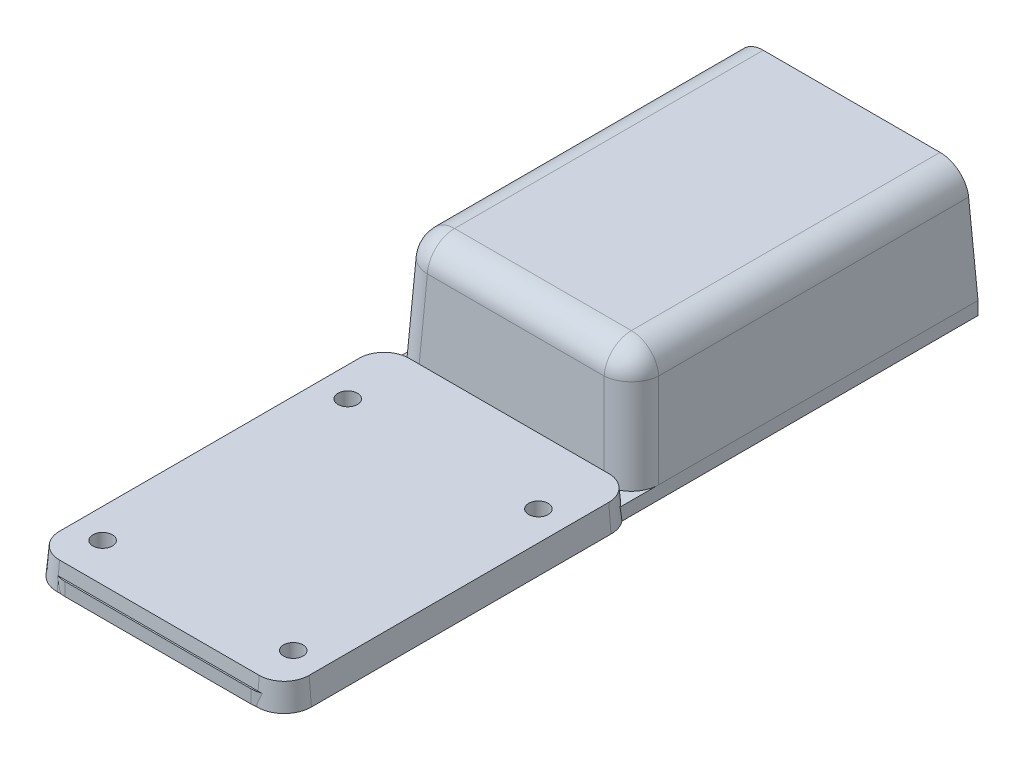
SolidWorks part; units mm, degrees
ref_plane "Front Plane" through (0, 0, 0) normal (0, 0, 1) x (1, 0, 0)
ref_plane "Top Plane" through (0, 0, 0) normal (0, 1, 0) x (1, 0, 0)
ref_plane "Right Plane" through (0, 0, 0) normal (1, 0, 0) x (0, 0, -1)
sketch "Sketch1" plane through (0, 0, 0) normal (0, 1, 0) x (1, 0, 0)
  line L1 (22, -39) -> (-22, -39)
  line L2 (28, -33) -> (28, 33)
  line L3 (22, 39) -> (-22, 39)
  line L4 (-28, -33) -> (-28, 33)
  line L5 (28, -39) -> (-28, 39) construction
  line L6 (28, 39) -> (-28, -39) construction
  arc A0 (-28, -33) -> (-22, -39) centre (-22, -33) ccw
  arc A1 (22, -39) -> (28, -33) centre (22, -33) ccw
  arc A2 (28, 33) -> (22, 39) centre (22, 33) ccw
  arc A3 (-22, 39) -> (-28, 33) centre (-22, 33) ccw
  point P0 (0, 0)
  dimension "D3" = 6
  dimension "D1" = 56
  dimension "D2" = 78
extrude "Boss-Extrude1" add sketch "Sketch1" along normal blind 5.8 draft 5
hole_wizard "Ø4.3 (4.3) Diameter Hole1" positions "Sketch4" profile "Sketch3" hole size "Ø4.3" standard "ANSI Metric"
sketch "Sketch4" plane through (0, 5.8, 0) normal (0, 1, 0) x (1, 0, 0)
  line L0 (0, 0) -> (0, -3) construction
  line L3 (21, -30) -> (-21, -30)
  line L4 (21, -30) -> (21, 24)
  line L5 (21, 24) -> (-21, 24)
  line L6 (-21, -30) -> (-21, 24)
  line L7 (21, -30) -> (-21, 24) construction
  line L8 (21, 24) -> (-21, -30) construction
  point P7 (-21, 24)
  point P208 (21, -30)
  point P209 (21, 24)
  point P210 (-21, -30)
  dimension "D1" = 3
  dimension "D2" = 42
  dimension "D3" = 54
sketch "Sketch3" plane through (-21, 5.8, -24) normal (1, 0, 0) x (0, 0, 1)
  line L0 (0, 0) -> (0, 5.8)
  line L1 (0, 5.8) -> (2.15, 5.8)
  line L2 (2.15, 5.8) -> (2.15, 0)
  line L5 (2.15, 0) -> (0, 0)
  line L11 (0, -6.35) -> (0, 107.95) construction
  dimension "Thru Hole Dia." = 4.3
  dimension "Thru Hole Depth" = 5.8
sketch "Sketch6" plane through (0, 0, 0) normal (0, -1, 0) x (-1, 0, 0)
  line L0 (26.2612, -33.0766) -> (26.2612, 115.1014)
  line L1 (20.2612, -39.0766) -> (-20.7388, -39.0766)
  line L2 (26.2612, 115.1014) -> (-26.7388, 115.1014)
  line L3 (-26.7388, -33.0766) -> (-26.7388, 115.1014)
  line L4 (26.2612, -39.0766) -> (-26.7388, 115.1014) construction
  line L5 (26.2612, 115.1014) -> (-26.7388, -39.0766) construction
  arc A0 (-26.7388, -33.0766) -> (-20.7388, -39.0766) centre (-20.7388, -33.0766) ccw
  arc A1 (26.2612, -33.0766) -> (20.2612, -39.0766) centre (20.2612, -33.0766) cw
  point P1 (-0.2388, 38.0124)
  dimension "D3" = 6
  dimension "D1" = 53
  dimension "D2" = 154.178
extrude "Boss-Extrude2" add sketch "Sketch6" against normal blind 2.9
hole_wizard "Ø4.3 (4.3) Diameter Hole2" positions "3DSketch1" profile "Sketch8" hole size "Ø4.3" standard "ANSI Metric"
sketch3d "3DSketch1"
  line L0 (-21, 2.9, -24) -> (-21, 5.8, -24) construction
  line L1 (21, 2.9, -24) -> (21, 5.8, -24) construction
  line L2 (21, 2.9, 30) -> (21, 5.8, 30) construction
  line L3 (-21, 2.9, 30) -> (-21, 5.8, 30) construction
  point P0 (-21, 5.8, -24)
  point P5 (-21, 5.8, -24)
  point P7 (21, 5.8, -24)
  point P11 (21, 5.8, 30)
  point P15 (-21, 5.8, 30)
sketch "Sketch8" plane through (-21, 5.8, -24) normal (1, 0, 0) x (0, 0, 1)
  line L0 (0, 0) -> (0, 5.8)
  line L1 (0, 5.8) -> (2.15, 5.8)
  line L2 (2.15, 5.8) -> (2.15, 0)
  line L5 (2.15, 0) -> (0, 0)
  line L11 (0, -6.35) -> (0, 107.95) construction
  dimension "Thru Hole Dia." = 4.3
  dimension "Thru Hole Depth" = 5.8
sketch "Sketch18" plane through (0, 2.9, 0) normal (0, 1, 0) x (1, 0, 0)
  line L0 (26.7388, 115.1014) -> (26.7388, 36.2502) construction
  line L1 (26.7388, 38.7463) -> (-26.2612, 38.7463)
  line L2 (26.7388, 38.7463) -> (26.7388, 115.1014)
  line L3 (26.7388, 115.1014) -> (-26.2612, 115.1014)
  line L4 (-26.2612, 38.7463) -> (-26.2612, 115.1014)
  point P6 (0, 0)
extrude "Boss-Extrude4" add sketch "Sketch18" along normal blind 25.4 draft 3
sketch "Sketch20" plane through (0, 0, -115.1014) normal (0, 0, -1) x (-1, 0, 0)
  line L1 (-22.1713, 23.907) -> (21.5492, 23.907)
  line L2 (-22.1713, 23.907) -> (-22.1713, 6.805)
  line L3 (-22.1713, 6.805) -> (21.5492, 6.805)
  line L4 (21.5492, 23.907) -> (21.5492, 6.805)
extrude "Cut-Extrude2" cut sketch "Sketch20" against normal blind 71.882
fillet "Fillet2" radius 6 5 edges at (26.0732, 15.6, -39.4119) (-25.5956, 15.6, -39.4119) (0.2388, 28.3, -40.0774) (25.4076, 28.3, -76.9238) (-24.9301, 28.3, -76.9238)
